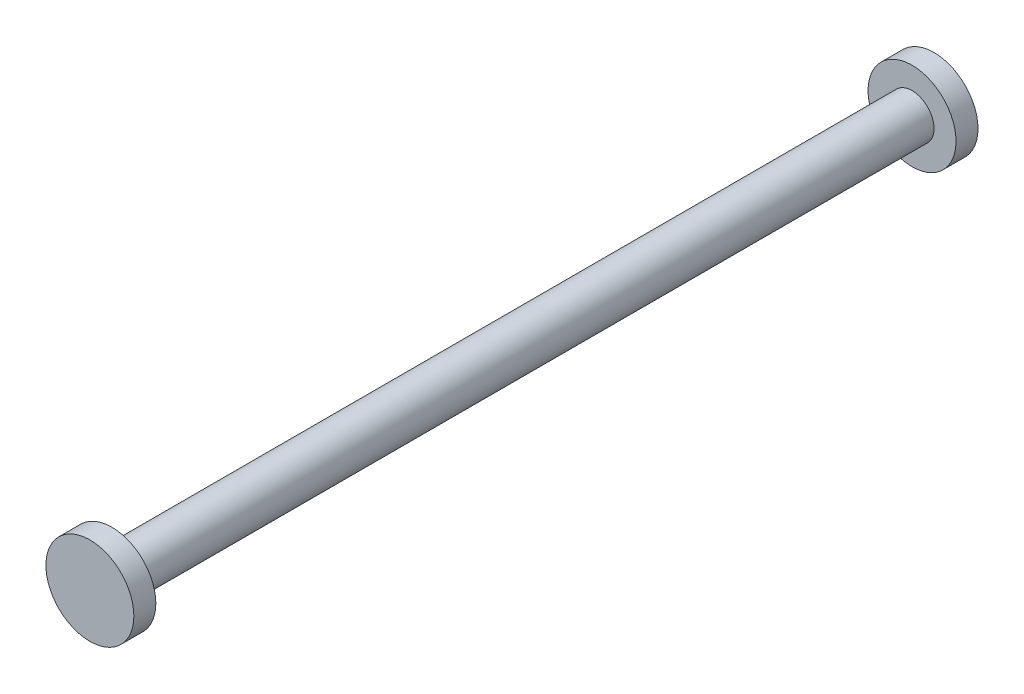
SolidWorks part; units mm, degrees
ref_plane "Front Plane" through (0, 0, 0) normal (0, 0, 1) x (1, 0, 0)
ref_plane "Top Plane" through (0, 0, 0) normal (0, 1, 0) x (1, 0, 0)
ref_plane "Right Plane" through (0, 0, 0) normal (1, 0, 0) x (0, 0, -1)
sketch "Sketch1" plane through (0, 0, 0) normal (0, 0, 1) x (1, 0, 0)
  circle A0 centre (0, 0) radius 10
extrude "Boss-Extrude1" add sketch "Sketch1" along normal blind 5
sketch "Sketch2" plane through (0, 0, 5) normal (0, 0, 1) x (1, 0, 0)
  circle A0 centre (0, 0) radius 5
extrude "Boss-Extrude2" add sketch "Sketch2" along normal blind 182
sketch "Sketch3" plane through (0, 0, 187) normal (0, 0, 1) x (1, 0, 0)
  circle A0 centre (0, 0) radius 10
extrude "Boss-Extrude3" add sketch "Sketch3" along normal blind 5
